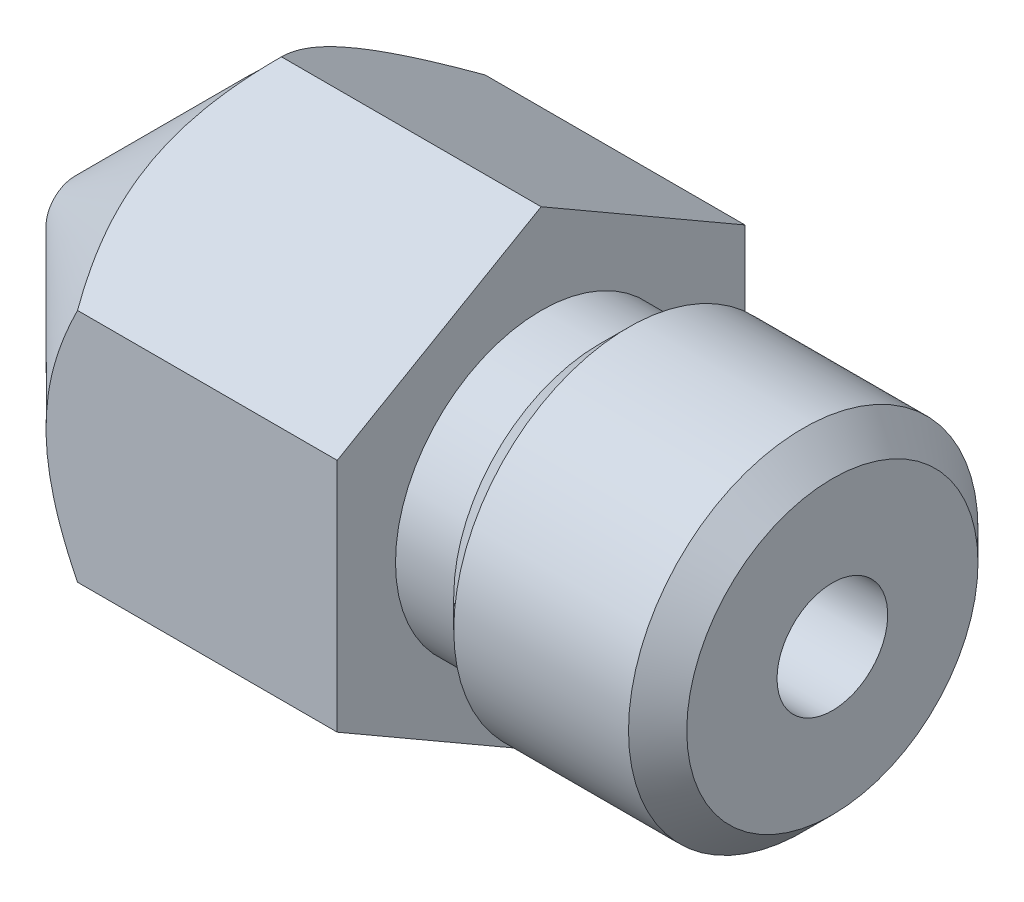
SolidWorks part; units mm, degrees
ref_plane "Plan de face" through (0, 0, 0) normal (0, 0, 1) x (1, 0, 0)
ref_plane "Plan de dessus" through (0, 0, 0) normal (0, 1, 0) x (1, 0, 0)
ref_plane "Plan de droite" through (0, 0, 0) normal (1, 0, 0) x (0, 0, -1)
sketch "Esquisse1" plane through (0, 0, 0) normal (0, 0, 1) x (1, 0, 0)
  line L0 (1.25, 0.2) -> (2, 0.95)
  line L1 (2, 0.95) -> (13, 0.95)
  line L2 (13, 0.95) -> (13, 3)
  line L3 (13, 3) -> (9, 3)
  line L4 (9, 3) -> (9, 2.5)
  line L5 (9, 2.5) -> (8, 2.5)
  line L6 (8, 2.5) -> (8, 4.5)
  line L7 (8, 4.5) -> (4, 4.5)
  line L8 (4, 4.5) -> (0, 0.5)
  line L10 (0, 0.2) -> (1.25, 0.2)
  line L12 (0, 0.5) -> (0, 0.2)
  line L13 (0, 0) -> (13.8194, 0) construction
  dimension "D1" = 13
  dimension "D2" = 45
  dimension "D3" = 0.2
  dimension "D4" = 0.95
  dimension "D5" = 2.5
  dimension "D6" = 3
  dimension "D7" = 11
  dimension "D8" = 9
  dimension "D9" = 5
  dimension "D10" = 4
  dimension "D11" = 4.5
revolve "Révolution1" add sketch "Esquisse1" angle 360 about L13
sketch "Esquisse2" plane through (8, 0, 0) normal (1, 0, 0) x (0, 0, -1)
  line L1 (-3.5, -2.0207) -> (0, -4.0415)
  line L2 (0, -4.0415) -> (3.5, -2.0207)
  line L3 (3.5, -2.0207) -> (3.5, 2.0207)
  line L4 (3.5, 2.0207) -> (0, 4.0415)
  line L5 (0, 4.0415) -> (-3.5, 2.0207)
  line L6 (-3.5, 2.0207) -> (-3.5, -2.0207)
  circle A0 centre (0, 0) radius 3.5 construction
  dimension "D1" = 7
extrude "Enlèv. mat.-Extru.1" cut sketch "Esquisse2" against normal blind 10 flip side to cut
chamfer "Chanfrein1" distance 0.5 angle 45 2 edges at (13, 0, 3) (9, 0, 3)
